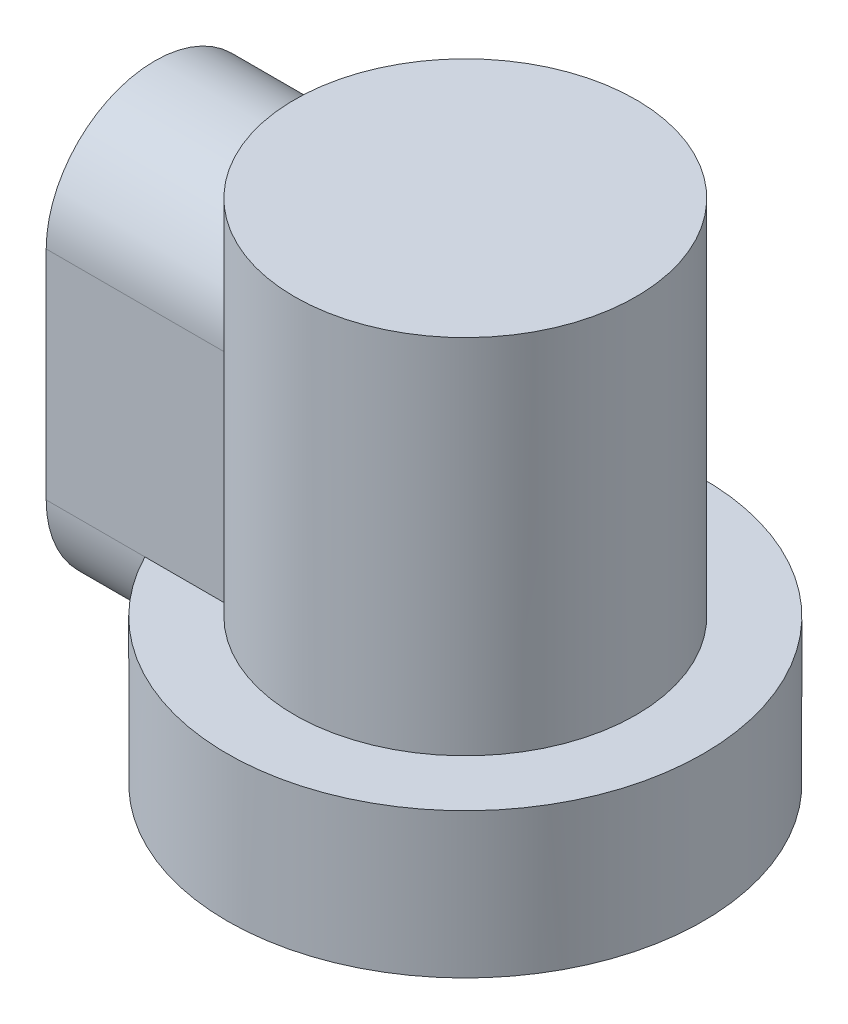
SolidWorks part; units mm, degrees
ref_plane "前视基准面" through (0, 0, 0) normal (0, 0, 1) x (1, 0, 0)
ref_plane "上视基准面" through (0, 0, 0) normal (0, 1, 0) x (1, 0, 0)
ref_plane "右视基准面" through (0, 0, 0) normal (1, 0, 0) x (0, 0, -1)
sketch "草图1" plane through (0, 0, 0) normal (0, 1, 0) x (1, 0, 0)
  circle A0 centre (0, 0) radius 92
extrude "拉伸1" add sketch "草图1" along normal blind 56
sketch "草图2" plane through (0, 56, 0) normal (0, 1, 0) x (1, 0, 0)
  circle A0 centre (0, 0) radius 66
extrude "拉伸2" add sketch "草图2" along normal blind 140
sketch "草图3" plane through (0, 0, 0) normal (1, 0, 0) x (0, 0, -1)
  line L0 (0, 96.9147) -> (0, 132.3669) construction
  line L2 (-42, 140) -> (-42, 56)
  line L4 (42, 140) -> (42, 56)
  arc A0 (42, 140) -> (-42, 140) centre (0, 140) ccw
  arc A1 (-42, 56) -> (42, 56) centre (0, 56) ccw
  dimension "D2" = 84
extrude "拉伸3" add sketch "草图3" against normal blind 120
